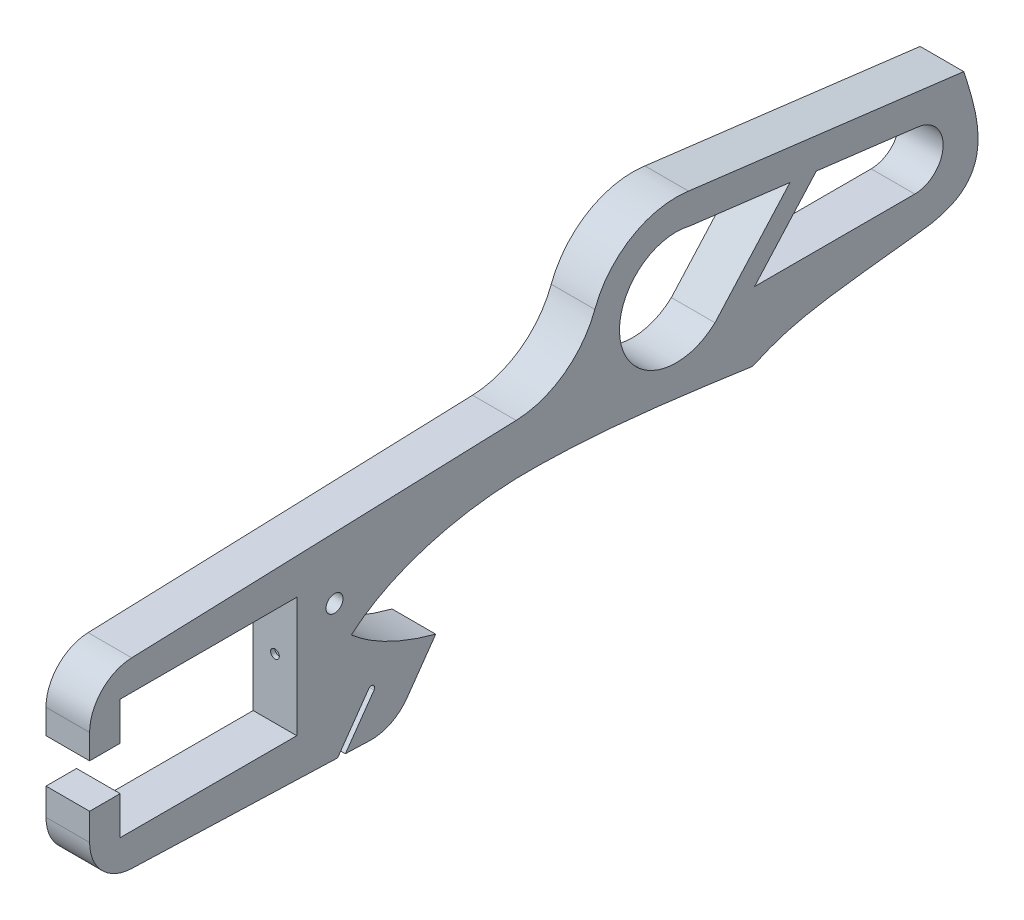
SolidWorks part; units mm, degrees
ref_plane "Plan de face" through (0, 0, 0) normal (0, 0, 1) x (1, 0, 0)
ref_plane "Plan de dessus" through (0, 0, 0) normal (0, 1, 0) x (1, 0, 0)
ref_plane "Plan de droite" through (0, 0, 0) normal (1, 0, 0) x (0, 0, -1)
sketch "Esquisse1" plane through (0, 0, 0) normal (1, 0, 0) x (0, 0, -1)
  line L0 (-79.0921, 0) -> (468.674, 0) construction
  line L1 (0, -28.3155) -> (0, 75.1731) construction
  line L2 (9.6816, -28.3155) -> (9.6816, 75.1731) construction
  line L3 (19.3632, -28.3155) -> (19.3632, 75.1731) construction
  line L4 (29.0448, -28.3155) -> (29.0448, 75.1731) construction
  line L5 (38.7264, -28.3155) -> (38.7264, 75.1731) construction
  line L6 (48.408, -28.3155) -> (48.408, 75.1731) construction
  line L7 (58.0895, -28.3155) -> (58.0895, 75.1731) construction
  line L8 (67.7711, -28.3155) -> (67.7711, 75.1731) construction
  line L9 (77.4527, -28.3155) -> (77.4527, 75.1731) construction
  line L10 (87.1343, -28.3155) -> (87.1343, 75.1731) construction
  line L11 (96.8159, -28.3155) -> (96.8159, 75.1731) construction
  line L12 (106.4975, -28.3155) -> (106.4975, 75.1731) construction
  line L13 (116.1791, -28.3155) -> (116.1791, 75.1731) construction
  line L14 (125.8607, -28.3155) -> (125.8607, 75.1731) construction
  line L15 (135.5423, -28.3155) -> (135.5423, 75.1731) construction
  line L17 (7.1453, 6) -> (11.5459, 6) construction
  line L18 (18.0174, 10) -> (22.1592, 10) construction
  line L19 (28.8895, 11.5) -> (33.4196, 11.5) construction
  line L20 (38.079, 12.2) -> (41.0559, 12.2) construction
  line L21 (47.7863, 11.5) -> (51.7986, 11.5) construction
  line L22 (58.6584, 11) -> (61.5059, 11) construction
  line L23 (68.3657, 10) -> (70.9543, 10) construction
  line L24 (76.7786, 9) -> (81.4381, 9) construction
  line L25 (86.7447, 7.5) -> (91.5337, 7.5) construction
  line L31 (-60, -34.5527) -> (-60, 97.3704) construction
  line L32 (25.8302, 24) -> (38.079, 24) construction
  line L33 (-79.0921, 20.5) -> (-63.6349, 20.5) construction
  line L34 (-50.3479, 20.6462) -> (37.7981, 23.7145)
  line L41 (140.4347, 41.6613) -> (77.3318, 49.4859)
  line L42 (-50.3479, -21.2031) -> (4.2664, -23.1042)
  line L44 (83.392, 20.3151) -> (100.5902, 39.5578)
  line L52 (12.7966, -18.8591) -> (19.3632, -9.5129)
  line L53 (-60, 10.6522) -> (-60, 5)
  line L54 (-81.1724, 5) -> (-63.0165, 5) construction
  line L55 (-53, 33.2498) -> (-53, -28.3155) construction
  line L56 (-12.5, 33.2498) -> (-12.5, -28.3155) construction
  line L57 (-82.6543, 13.75) -> (-22.9644, 13.75) construction
  line L58 (-82.6543, -13.75) -> (-22.9644, -13.75) construction
  line L59 (-60, 5) -> (-53, 5)
  line L60 (-53, 13.75) -> (-12.5, 13.75)
  line L61 (-53, 13.75) -> (-53, 5)
  line L62 (-53, -13.75) -> (-12.5, -13.75)
  line L63 (-12.5, 13.75) -> (-12.5, -13.75)
  line L64 (-60, -5) -> (-53, -5)
  line L65 (-53, -5) -> (-53, -13.75)
  line L66 (-60, -5) -> (-60, -11.2092)
  line L67 (116.1791, 36.5299) -> (77.4527, 9.3354) construction
  line L68 (106.6271, 38.8093) -> (92.4605, 22.9584)
  line L70 (130.0034, 35.9107) -> (106.6271, 38.8093)
  line L71 (92.4605, 22.9584) -> (129.2034, 22.9584)
  line L72 (100.5902, 39.5578) -> (77.67, 42.3998)
  arc A0 (-50.3479, 20.6462) -> (-60, 10.6522) centre (-50, 10.6522) ccw
  arc A1 (-50.3479, -21.2031) -> (-60, -11.2092) centre (-50, -11.2092) cw
  arc A2 (12.7966, -18.8591) -> (4.2664, -23.1042) centre (4.6143, -13.1103) cw
  arc A3 (77.3318, 49.4859) -> (55.8476, 36.7298) centre (74.4949, 29.7935) ccw
  arc A4 (77.67, 42.3998) -> (83.392, 20.3151) centre (74.4949, 29.7935) ccw
  circle A5 centre (-3.8552, 8.1877) radius 1.95
  arc A8 (129.2034, 22.9584) -> (130.0034, 35.9107) centre (129.2034, 29.4593) ccw
  arc A9 (37.7981, 23.7145) -> (55.8476, 36.7298) centre (37.1024, 43.7024) ccw
  spline S0 degree 3 poles (0, 0) (10.0229, 8.6747) (26.5039, 12.1434) (52.9502, 12.2543) (70.5875, 10.3618) (88.0257, 7.8975) (92.0238, 7.3286) knots 0 0 0 0 0.28008 0.28008 0.548832 0.629025 0.629025 0.629025 0.629025
  spline S1 degree 3 poles (0, 0) (5.1687, -4.4734) (12.0547, -7.5624) (19.3632, -9.5129) knots 0 0 0 0 0.144432 0.144432 0.144432 0.144432
  spline S3 degree 3 poles (92.0238, 7.3286) (101.6159, 11.7809) (108.3863, 12.2893) (147.6931, 16.831) (144.5678, 28.986) (140.4347, 41.6613) knots 0.115775 0.115775 0.115775 0.115775 0.613382 0.613382 0.980333 0.980333 0.980333 0.980333
  point P110 (-60, 20.3102)
  point P116 (9.6816, -23.2927)
  dimension "D16" = 10
  dimension "D17" = 5
  dimension "D6" = 5
  dimension "D2" = 60
  dimension "D3" = 20.5
  dimension "D4" = 24
  dimension "D12" = 40.5
  dimension "D13" = 27.5
  dimension "D14" = 13.75
  dimension "D15" = 7
extrude "Extrusion1" add sketch "Esquisse1" along normal blind 10
sketch "Esquisse2" plane through (0, 0, 12.5) normal (0, 0, 1) x (1, 0, 0)
  line L0 (-1.8232, 0) -> (13.588, 0) construction
  line L1 (5, 4.5284) -> (5, -1.8452) construction
  circle A0 centre (5, 0) radius 1
extrude "Enlèv. mat.-Extru.1" cut sketch "Esquisse2" against normal blind 1
sketch "Esquisse3" plane through (0, 0, 0) normal (-1, 0, 0) x (0, 0, 1)
  line L0 (-12.4117, -2.0123) -> (3.5703, -24.7593) construction
  line L1 (-11.8039, -1.5726) -> (5.5557, -26.2805) construction
  line L2 (-13.0182, -2.4536) -> (4.2817, -27.0765) construction
  line L3 (-12.7966, -18.8591) -> (-19.3632, -9.5129) construction
  line L4 (-12.7966, -18.8591) -> (-1.3438, -10.8125) construction
  line L5 (-4.0006, -12.6791) -> (3.6792, -23.6098)
  line L6 (3.6792, -23.6098) -> (2.4519, -24.4721)
  line L7 (2.4519, -24.4721) -> (-5.2279, -13.5414)
  arc A0 (-4.0006, -12.6791) -> (-5.2279, -13.5414) centre (-4.6143, -13.1103) ccw
  dimension "D1" = 10
  dimension "D2" = 0.75
  dimension "D3" = 1.5
extrude "Enlèv. mat.-Extru.2" cut sketch "Esquisse3" against normal blind 10
